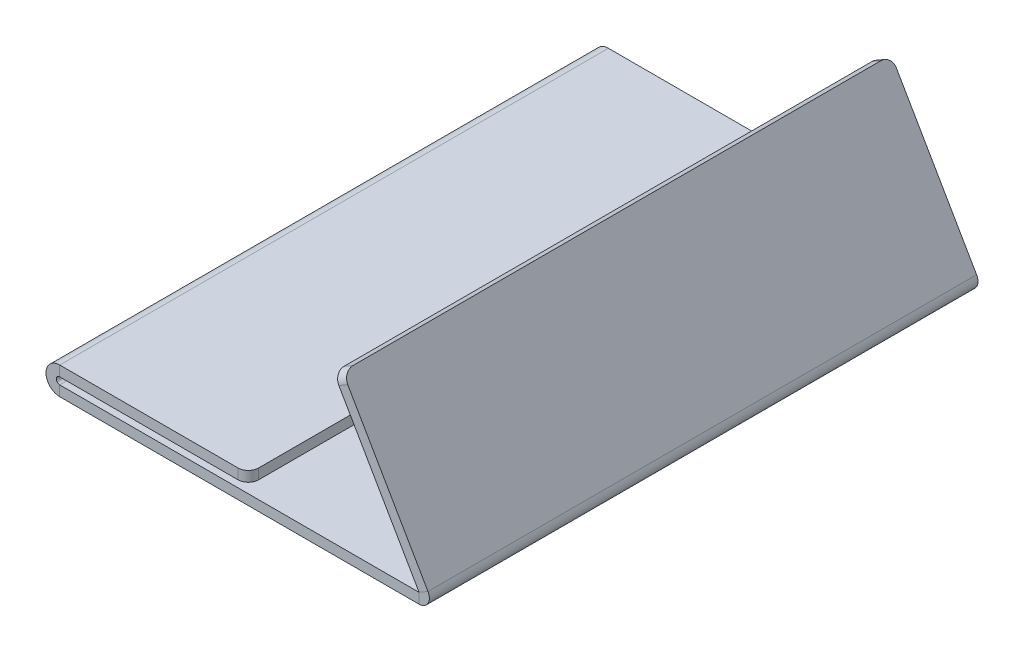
SolidWorks part; units mm, degrees
ref_plane "Front" through (0, 0, 0) normal (0, 0, 1) x (1, 0, 0)
ref_plane "Top" through (0, 0, 0) normal (0, 1, 0) x (1, 0, 0)
ref_plane "Right" through (0, 0, 0) normal (1, 0, 0) x (0, 0, -1)
sketch "Sketch1" plane through (0, 0, 0) normal (0, 1, 0) x (1, 0, 0)
  line L1 (0, 0) -> (220, 0)
  line L2 (0, 0) -> (0, 160)
  line L3 (0, 160) -> (220, 160)
  line L6 (220, 0) -> (220, 160)
sheet metal parameters "Sheet-Metal1" thickness 3 parameters "D1"=0.01
base flange "Base-Flange1" sketch "Sketch1" thickness 3 reverse thickness direction yes parameters "D1"=0.01
sketch "Sketch3" plane through (0, 3, 0) normal (0, 1, 0) x (-1, 0, 0)
  line L0 (-165, -160) -> (-165, 0)
sketched bend "Sketched Bend3" parameters "D1"=0.01
bend "SketchBend4" bend radius 0.01 bend angle 120 parameters "D5"=1
sketch "Sketch4" plane through (0, 3, 0) normal (0, 1, 0) x (-1, 0, 0)
  line L1 (-55, 0) -> (-55, -160)
sketched bend "Sketched Bend5" parameters "D1"=1.01
bend "SketchBend6" bend radius 1.01 bend angle 180 parameters "D5"=2
fillet "Fillet1" radius 3 4 edges at (110, 6.52, -160) (110, 6.52, 0) (136.2035, 46.8857, 0) (136.2035, 46.8857, -160)
flat pattern "Flat-Pattern1"
sketch "Bend-Lines1" plane through (0, 0, 0) normal (0, 1, 0) x (-1, 0, 0)
bend of the flat pattern "Flatten-<SketchBend4>1"
bend of the flat pattern "Flatten-<SketchBend6>1"
